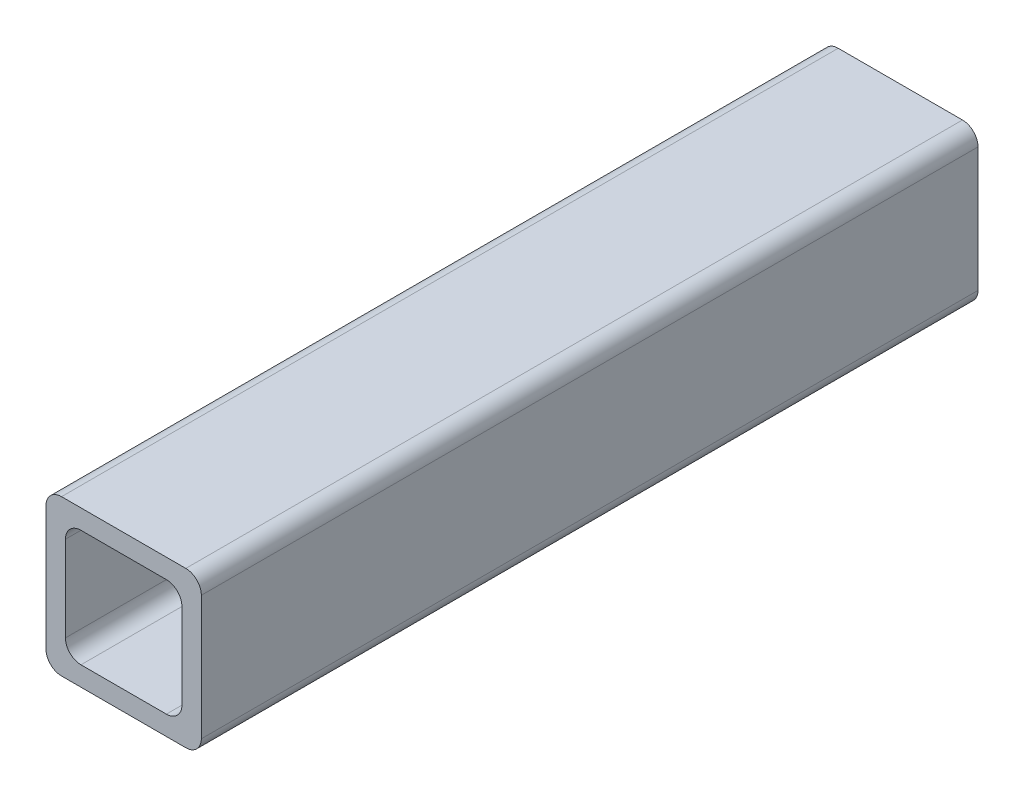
SolidWorks part; units mm, degrees
ref_plane "Plan de face" through (0, 0, 0) normal (0, 0, 1) x (1, 0, 0)
ref_plane "Plan de dessus" through (0, 0, 0) normal (0, 1, 0) x (1, 0, 0)
ref_plane "Plan de droite" through (0, 0, 0) normal (1, 0, 0) x (0, 0, -1)
sketch "Esquisse1" plane through (0, 0, 0) normal (0, 0, 1) x (1, 0, 0)
  line L0 (3.999, 7.5) -> (-7.001, 7.5)
  line L1 (6.499, -10) -> (-9.501, -10)
  line L2 (8.499, -8) -> (8.499, 8)
  line L3 (6.499, 10) -> (-9.501, 10)
  line L4 (-11.501, -8) -> (-11.501, 8)
  line L5 (-9.001, -5.5) -> (-9.001, 5.5)
  line L6 (3.999, -7.5) -> (-7.001, -7.5)
  line L7 (5.999, -5.5) -> (5.999, 5.5)
  line L8 (5.999, -7.5) -> (-9.001, -7.5) construction
  line L9 (5.999, -7.5) -> (5.999, 7.5) construction
  line L10 (-9.001, -7.5) -> (-9.001, 7.5) construction
  line L11 (8.499, -10) -> (-11.501, -10) construction
  line L12 (-11.501, -10) -> (-11.501, 10) construction
  line L13 (8.499, -10) -> (8.499, 10) construction
  line L14 (5.999, 7.5) -> (-9.001, 7.5) construction
  line L15 (8.499, 10) -> (-11.501, 10) construction
  arc A0 (3.999, -7.5) -> (5.999, -5.5) centre (3.999, -5.5) ccw
  arc A1 (-9.001, -5.5) -> (-7.001, -7.5) centre (-7.001, -5.5) ccw
  arc A2 (-9.501, -10) -> (-11.501, -8) centre (-9.501, -8) cw
  arc A3 (6.499, -10) -> (8.499, -8) centre (6.499, -8) ccw
  arc A4 (-7.001, 7.5) -> (-9.001, 5.5) centre (-7.001, 5.5) ccw
  arc A5 (3.999, 7.5) -> (5.999, 5.5) centre (3.999, 5.5) cw
  arc A6 (8.499, 8) -> (6.499, 10) centre (6.499, 8) ccw
  arc A7 (-9.501, 10) -> (-11.501, 8) centre (-9.501, 8) ccw
  point P0 (0, 0)
  point P19 (-11.501, -10)
  dimension "D4" = 2
  dimension "D3" = 2.5
extrude "Boss.-Extru.2" add sketch "Esquisse1" along normal blind 100
